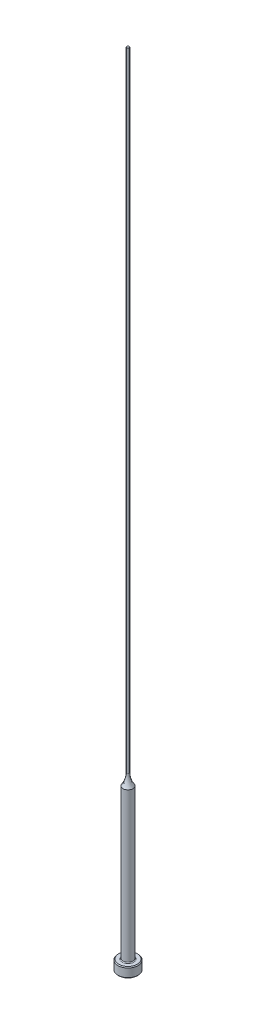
SolidWorks part; units mm, degrees
ref_plane "Front Plane" through (0, 0, 0) normal (0, 0, 1) x (1, 0, 0)
ref_plane "Top Plane" through (0, 0, 0) normal (0, 1, 0) x (1, 0, 0)
ref_plane "Right Plane" through (0, 0, 0) normal (1, 0, 0) x (0, 0, -1)
sketch "Sketch1" plane through (0, 0, 0) normal (0, 0, 1) x (1, 0, 0)
  line L0 (0, 259.9588) -> (0, -15.1925) construction
  line L1 (0, 0) -> (-3.175, 0)
  line L2 (-3.175, 0) -> (-3.175, 3.175)
  line L3 (-3.175, 3.175) -> (-1.5875, 3.175)
  line L4 (-0.3962, 54.5027) -> (-0.3962, 254)
  line L5 (-0.3962, 254) -> (0, 254)
  line L6 (0, 254) -> (0, 0)
  line L7 (-1.5875, 3.175) -> (-1.5875, 50.8)
  arc A0 (-1.5875, 50.8) -> (-0.3962, 54.5027) centre (-6.7462, 54.5027) ccw
  point P13 (-1.5875, 0)
  dimension "D1" = 6.35
  dimension "L" = 254
  dimension "D2" = 3.175
  dimension "H" = 6.35
  dimension "T" = 3.175
  dimension "D" = 0.7925
  dimension "S" = 50.8
revolve "Revolve1" add sketch "Sketch1" angle 360 about L0
chamfer "Chamfer1" distance 0.254 angle 45 2 edges at (0, 3.175, 3.175) (0, 0, 3.175)
fillet "Fillet1" radius 0.254 1 edges at (0, 3.175, 1.5875)
